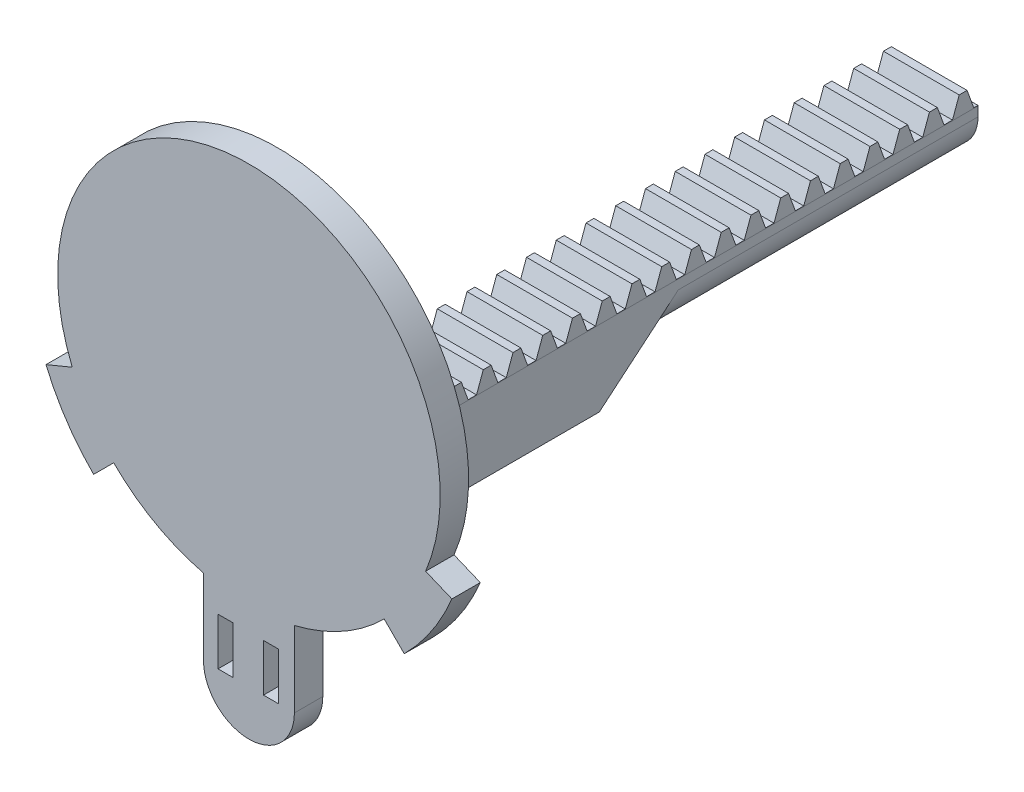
SolidWorks part; units mm, degrees
other "<ISO - Rack-spur - rectangular 1M 20PA 8FW 1PH 70L---SAll>-<TeethCuts>"
ref_plane "Front Plane" through (0, 0, 0) normal (0, 0, 1) x (1, 0, 0)
ref_plane "Top Plane" through (0, 0, 0) normal (0, 1, 0) x (1, 0, 0)
ref_plane "Right Plane" through (0, 0, 0) normal (1, 0, 0) x (0, 0, -1)
sketch "Sketch1" plane through (0, 0, 0) normal (0, 0, 1) x (1, 0, 0)
  line L1 (-4.8, -27.6214) -> (-4.8, -19.6214)
  line L2 (4.8, -27.6214) -> (4.8, -19.6214)
  line L5 (18.6624, -7.7302) -> (21.434, -8.8783)
  line L6 (14.2836, -14.2836) -> (16.4049, -16.4049)
  line L10 (-14.2836, -14.2836) -> (-16.4049, -16.4049)
  line L11 (-18.6624, -7.7302) -> (-21.434, -8.8783)
  arc A0 (4.8, -19.6214) -> (-4.8, -19.6214) centre (0, 0) ccw
  arc A1 (-21.434, -8.8783) -> (-16.4049, -16.4049) centre (0, 0) ccw
  arc A2 (16.4049, -16.4049) -> (21.434, -8.8783) centre (0, 0) ccw
  arc A3 (-4.8, -27.6214) -> (4.8, -27.6214) centre (0, -27.6214) ccw
  point P3 (0, -20.2)
  point P7 (0, -20.2)
  point P39 (0, 0)
  dimension "D1" = 40.4
  dimension "D2" = 46.4
  dimension "D5" = 9.6
  dimension "D3" = 9.6
  dimension "D4" = 8
extrude "Boss-Extrude1" add sketch "Sketch1" along normal blind 3 contours L6 A2 L5 A0 | A0 | L11 A1 L10 A0
sketch "Sketch2" plane through (0, 0, 0) normal (0, 0, -1) x (-1, 0, 0)
  line L0 (0, 0) -> (0, -10) construction
  line L2 (-4, -10) -> (-4, -6)
  line L3 (-4, -6) -> (4, -6)
  line L4 (4, -10) -> (4, -6)
  arc A0 (-4, -10) -> (4, -10) centre (0, -10) ccw
  dimension "D1" = 8
  dimension "D2" = 8
  dimension "D3" = 4
  dimension "D4" = 10
extrude "Boss-Extrude3" add sketch "Sketch2" along normal blind 70
sketch "Sketch4" plane through (0, -6, 0) normal (0, 1, 0) x (1, 0, 0)
  line L0 (4, 70) -> (4, 0) construction
  line L1 (-4, 70) -> (4, 70)
  line L2 (-4, 70) -> (-4, 0)
  line L3 (-4, 0) -> (4, 0)
  line L4 (4, 70) -> (4, 0)
extrude "Cut-Extrude2" cut sketch "Sketch4" against normal blind 3
inserted part "ISO - Rack-spur - rectangular 1M 20PA 8FW 1PH 70L---SAll"
move or copy body "Body-Move/Copy3" placed by mates yes parameters "D1"=0, "D2"=0, "D3"=0
sketch "Sketch8" plane through (0, 0, 0) normal (0, 0, -1) x (-1, 0, 0)
  line L1 (4, -10) -> (-4, -10)
  line L2 (4, -10) -> (4, -17)
  line L3 (4, -17) -> (-4, -17)
  line L4 (-4, -10) -> (-4, -17)
  dimension "D1" = 8
  dimension "D2" = 7
extrude "Boss-Extrude6" add sketch "Sketch8" along normal blind 30 contours L4 L3 L2 M4
draft "Draft8" type of draft neutral plane draft angle 50 faces to draft 1 parameters "D1"=50
sketch "Sketch9" plane through (0, 0, 3) normal (0, 0, 1) x (1, 0, 0)
  line L3 (1.5365, -22.6214) -> (1.5365, -27.6214)
  line L4 (-1.6635, -27.6214) -> (-1.6635, -22.6214)
  line L13 (-1.6635, -27.6214) -> (-3.2635, -27.6214)
  line L14 (-1.6635, -22.6214) -> (-3.2635, -22.6214)
  line L15 (-3.2635, -27.6214) -> (-3.2635, -22.6214)
  line L16 (1.5365, -27.6214) -> (3.1365, -27.6214)
  line L17 (1.5365, -22.6214) -> (3.1365, -22.6214)
  line L18 (3.1365, -27.6214) -> (3.1365, -22.6214)
  line L19 (-4.8, -19.6214) -> (4.8, -19.6214) construction
  line L20 (0, -19.6214) -> (0, -22.6214) construction
  line L21 (4.8, -22.6214) -> (-4.8, -22.6214)
  line L22 (-4.8, -27.6214) -> (-4.8, -19.6214) construction
  point P20 (0, -22.6214)
  dimension "D1" = 3
extrude "Cut-Extrude3" cut sketch "Sketch9" against normal blind 30 contours L15 L13 L4 L14 | L16 L18 L17 L3
